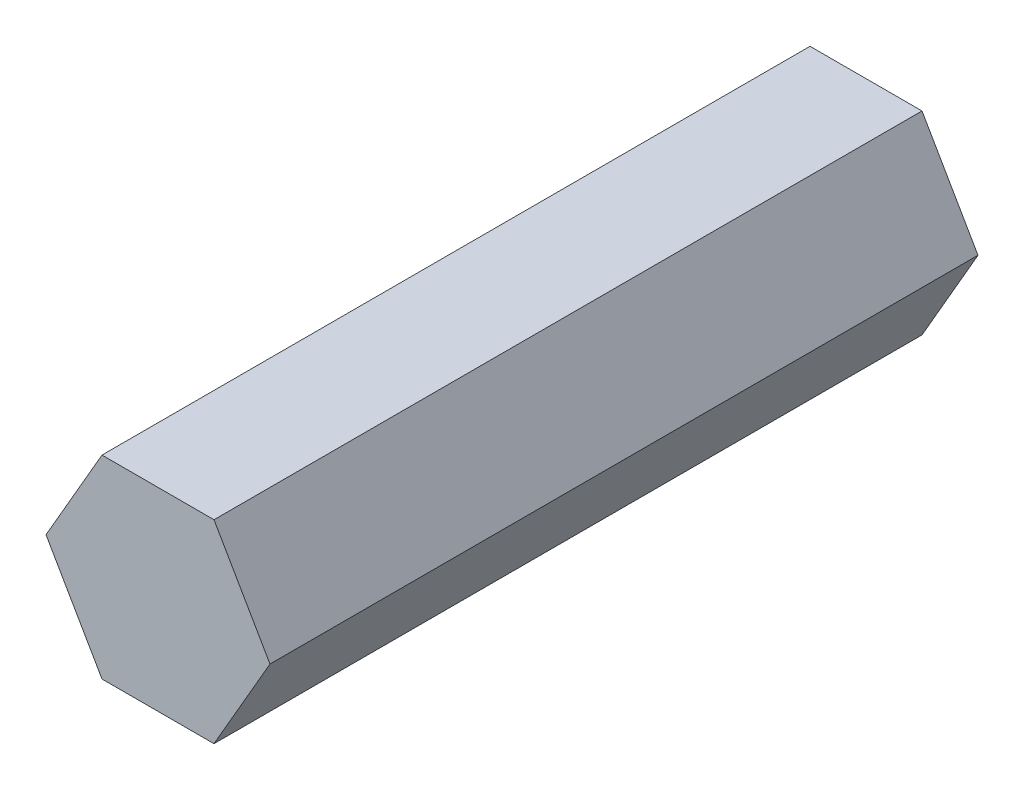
SolidWorks part; units mm, degrees
ref_plane "XZ (Face)" through (0, 0, 0) normal (0, 0, 1) x (1, 0, 0)
ref_plane "XY (Dessus)" through (0, 0, 0) normal (0, 1, 0) x (1, 0, 0)
ref_plane "YZ (Droite)" through (0, 0, 0) normal (1, 0, 0) x (0, 0, -1)
sketch "Esquisse1" plane through (0, 0, 0) normal (0, 0, 1) x (1, 0, 0)
  line L0 (2.3094, 0) -> (1.1547, 2) construction
  line L1 (1.1547, -2) -> (2.3094, 0) construction
  line L2 (-1.1547, -2) -> (1.1547, -2) construction
  line L3 (-2.3094, 0) -> (-1.1547, -2) construction
  line L4 (-1.1547, 2) -> (-2.3094, 0) construction
  line L5 (1.1547, 2) -> (-1.1547, 2) construction
  line L6 (2.3094, 0) -> (1.1547, 2)
  line L7 (1.1547, -2) -> (2.3094, 0)
  line L8 (-1.1547, -2) -> (1.1547, -2)
  line L9 (-2.3094, 0) -> (-1.1547, -2)
  line L10 (-1.1547, 2) -> (-2.3094, 0)
  line L11 (1.1547, 2) -> (-1.1547, 2)
extrude "Base-Extrusion" add sketch "Esquisse1" along normal up to surface (14.6 mm away)
